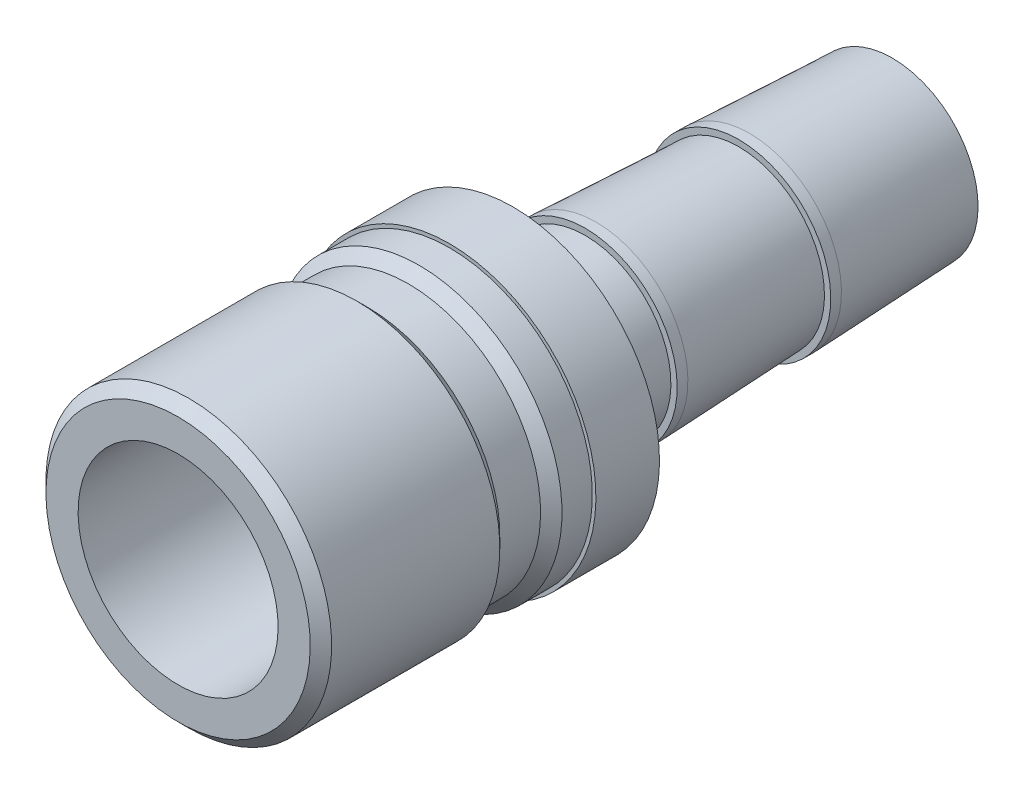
SolidWorks part; units mm, degrees
ref_plane "Front Plane" through (0, 0, 0) normal (0, 0, 1) x (1, 0, 0)
ref_plane "Top Plane" through (0, 0, 0) normal (0, 1, 0) x (1, 0, 0)
ref_plane "Right Plane" through (0, 0, 0) normal (1, 0, 0) x (0, 0, -1)
sketch "Sketch1" plane through (0, 0, 0) normal (1, 0, 0) x (0, 0, -1)
  line L0 (0, 0) -> (-22.479, 0) construction
  line L1 (-19.304, 7.112) -> (-19.304, 9.398)
  line L2 (-5.8166, 9.398) -> (-5.8166, 0) construction
  line L3 (-18.542, 10.16) -> (-6.5786, 10.16)
  line L4 (0, 10.414) -> (0, 0) construction
  line L5 (-5.8166, 9.398) -> (-2.921, 9.398)
  line L6 (-2.159, 10.16) -> (0, 10.16)
  line L8 (-5.8166, 9.398) -> (-6.5786, 10.16)
  line L9 (-2.921, 9.398) -> (-2.159, 10.16)
  line L10 (-19.304, 9.398) -> (-18.542, 10.16)
  line L11 (-3.6608, 5.1594) -> (31.496, 5.1594)
  line L13 (7.366, 6.096) -> (9.652, 6.096)
  line L14 (31.496, 6.096) -> (31.496, 5.1594)
  line L15 (43.2463, 0) -> (0, 0) construction
  line L16 (-19.304, 7.112) -> (-4.699, 7.112)
  line L17 (-4.699, 7.112) -> (-3.6608, 5.1594)
  line L18 (9.652, 6.096) -> (9.652, 6.5405)
  line L19 (9.652, 6.5405) -> (10.414, 6.5405)
  line L20 (10.414, 6.5405) -> (20.574, 6.096)
  line L21 (20.574, 6.096) -> (20.574, 6.5405)
  line L22 (20.574, 6.5405) -> (21.336, 6.5405)
  line L23 (21.336, 6.5405) -> (31.496, 6.096)
  line L24 (0, 10.16) -> (0, 10.414)
  line L25 (0, 10.414) -> (4.5212, 10.414)
  line L26 (4.5212, 10.414) -> (4.5212, 6.5405)
  line L27 (4.5212, 6.5405) -> (7.366, 6.096)
  dimension "D2" = 2.8956
  dimension "D3" = 0.762
  dimension "D4" = 45
  dimension "D5" = 13.4874
  dimension "D6" = 45
  dimension "D7" = 13.081
  dimension "D8" = 12.192
  dimension "D9" = 50.8
  dimension "D10" = 10.922
  dimension "D11" = 0.762
  dimension "D12" = 10.3187
  dimension "D13" = 2.286
  dimension "D14" = 20.32
  dimension "D15" = 118
  dimension "D16" = 14.224
  dimension "D17" = 14.605
  dimension "D18" = 20.828
  dimension "D19" = 26.9748
  dimension "D20" = 19.304
revolve "Revolve1" add sketch "Sketch1" angle 360 about L0
